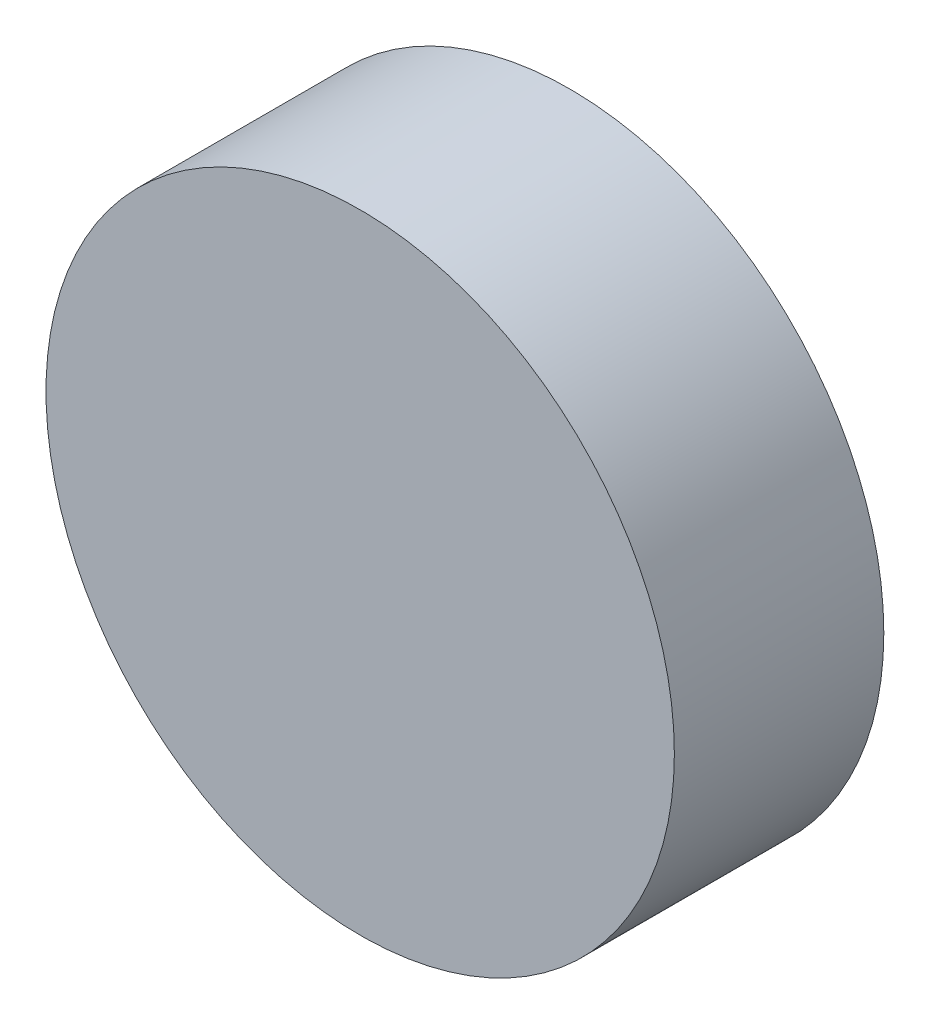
SolidWorks part; units mm, degrees
ref_plane "Bottom Plane" through (0, 0, 0) normal (0, 0, 1) x (1, 0, 0)
ref_plane "Front Plane" through (0, 0, 0) normal (0, 1, 0) x (1, 0, 0)
ref_plane "Left Plane" through (0, 0, 0) normal (1, 0, 0) x (0, 0, -1)
ref_plane "Right Plane" through (762, 0, 0) normal (1, 0, 0) x (0, 0, -1)
ref_plane "Back Plane" through (0, 558.8, 0) normal (0, 1, 0) x (1, 0, 0)
ref_plane "Top Plane" through (0, 0, 41.275) normal (0, 0, 1) x (1, 0, 0)
ref_plane "Half Length" through (381, 0, 0) normal (1, 0, 0) x (0, 0, -1)
ref_plane "Half Width" through (0, 279.4, 0) normal (0, 1, 0) x (1, 0, 0)
sketch "Sketch1" plane through (0, 0, 0) normal (0, 0, 1) x (1, 0, 0)
  circle A0 centre (0, 0) radius 9.525
  dimension "D1" = 19.05
extrude "Boss-Extrude1" add sketch "Sketch1" along normal blind 6.35
